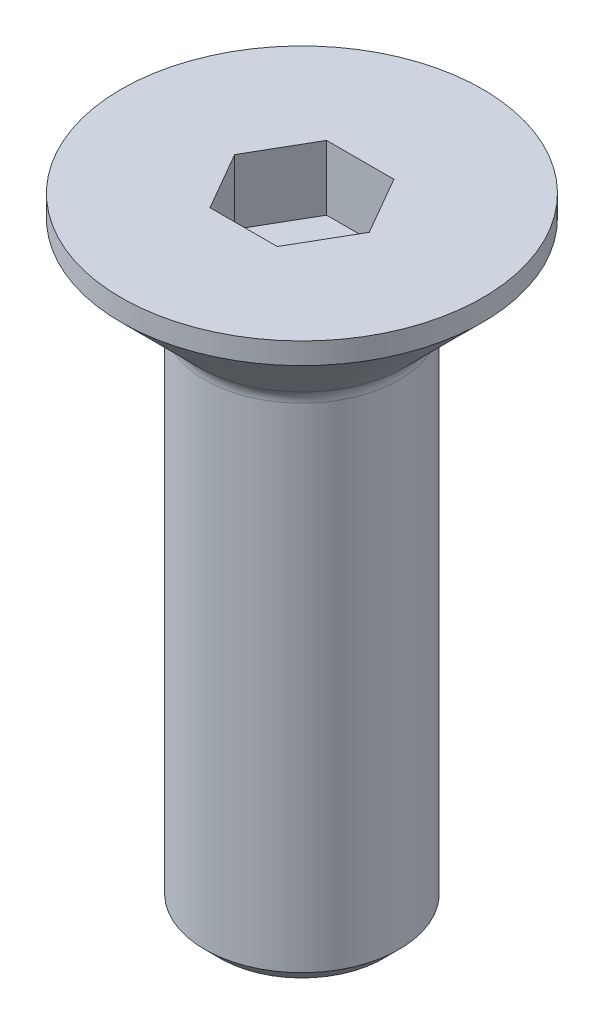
SolidWorks part; units mm, degrees
ref_plane "Plan1" through (0, 0, 0) normal (0, 0, 1) x (1, 0, 0)
ref_plane "Plan2" through (0, 0, 0) normal (0, 1, 0) x (1, 0, 0)
ref_plane "Plan3" through (0, 0, 0) normal (1, 0, 0) x (0, 0, -1)
sketch "Esquisse1" plane through (0, 0, 0) normal (0, 0, 1) x (1, 0, 0)
  line L0 (0, 0) -> (0, -16) construction
  line L1 (4.65, -0.55) -> (2.6464, -2.5536)
  line L2 (4.65, -0.55) -> (4.65, 0)
  line L3 (4.65, 0) -> (0, 0)
  line L4 (2.5, -2.9071) -> (2.5, -15.6)
  line L5 (2.1, -16) -> (0, -16)
  line L6 (2.5, -15.6) -> (2.1, -16)
  line L7 (0, 0) -> (0, -16)
  line L8 (2.6464, -2.5536) -> (2.5, -2.7) construction
  line L9 (2.5, -2.9071) -> (2.5, -2.7) construction
  arc A0 (2.6464, -2.5536) -> (2.5, -2.9071) centre (3, -2.9071) ccw
  point P12 (2.5, -16)
revolve "Révolution1" add sketch "Esquisse1" angle 360 about L0
sketch "Esquisse2" plane through (0, 0, 0) normal (0, 1, 0) x (1, 0, 0)
  line L1 (1.7321, 0) -> (0.866, 1.5)
  line L2 (0.866, 1.5) -> (-0.866, 1.5)
  line L3 (-0.866, 1.5) -> (-1.7321, 0)
  line L4 (-1.7321, 0) -> (-0.866, -1.5)
  line L5 (-0.866, -1.5) -> (0.866, -1.5)
  line L6 (0.866, -1.5) -> (1.7321, 0)
  circle A0 centre (0, 0) radius 1.5 construction
  dimension "S" = 3
extrude "Enlèv. mat.-Extru.1" cut sketch "Esquisse2" against normal blind 1.6667
equation "\"R@Esquisse1\"=(\"D@Esquisse1\"-\"D2@Représentation de filetage1\")/2"
equation "\"C@Esquisse1\"=\"D@Esquisse1\"/10"
equation "\"Prof@Enlèv. mat.-Extru.1\"=\"D@Esquisse1\"/3"
